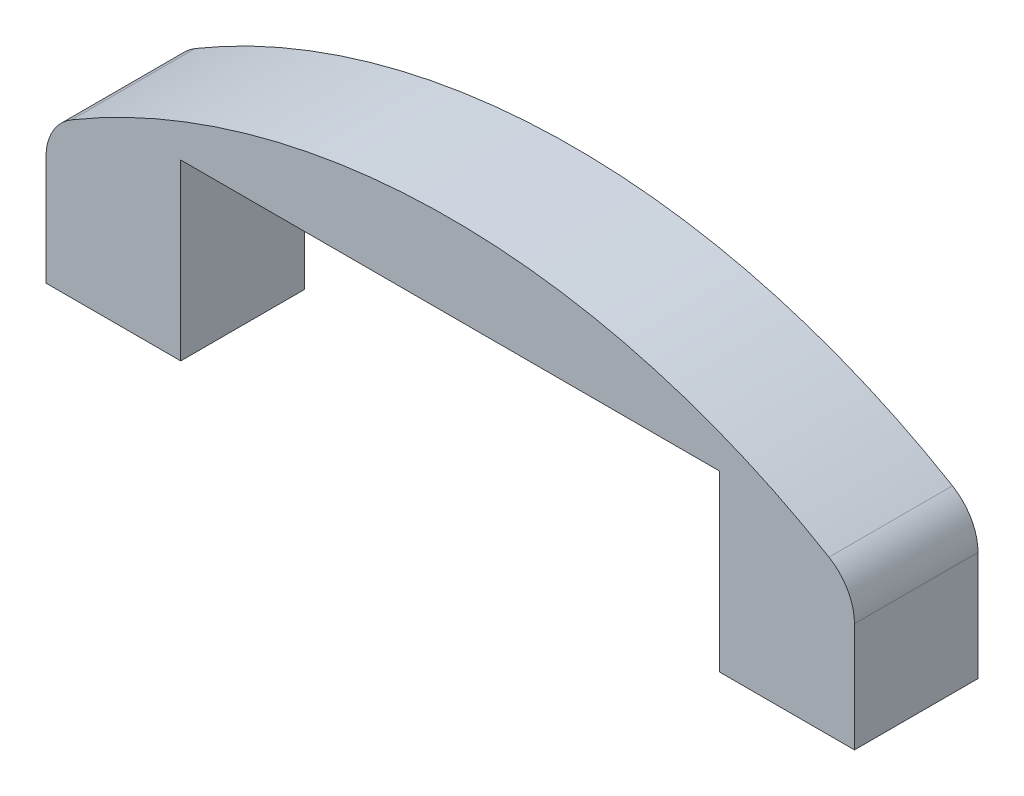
SolidWorks part; units mm, degrees
ref_plane "Plan de face" through (0, 0, 0) normal (0, 0, 1) x (1, 0, 0)
ref_plane "Plan de dessus" through (0, 0, 0) normal (0, 1, 0) x (1, 0, 0)
ref_plane "Plan de droite" through (0, 0, 0) normal (1, 0, 0) x (0, 0, -1)
ref_plane "Plan1" through (0, 0, 11) normal (0, 0, 1) x (1, 0, 0)
sketch "Esquisse1" plane through (0, 0, 11) normal (0, 0, 1) x (1, 0, 0)
  line L0 (-12, 24.6345) -> (-12, 0)
  line L1 (-12, 0) -> (132, 0)
  line L2 (132, 0) -> (132, 24.6345)
  arc A0 (132, 24.6345) -> (-12, 24.6345) centre (60, -86) ccw
  dimension "D1" = 132
  dimension "D2" = 72
  dimension "D3" = 24.6345
extrude "Boss.-Extru.1" add sketch "Esquisse1" against normal blind 22
sketch "Esquisse2" plane through (0, 0, -11) normal (0, 0, -1) x (-1, 0, 0)
  line L0 (-108, 0) -> (-12, 0)
  line L1 (-12, 0) -> (-12, 31)
  line L2 (-12, 31) -> (-108, 31)
  line L3 (-108, 31) -> (-108, 0)
  line L4 (12, 24.6345) -> (12, 0) construction
  line L5 (12, 0) -> (-132, 0) construction
  dimension "D1" = 24
  dimension "D2" = 120
  dimension "D3" = 31
extrude "Enlèv. mat.-Extru.1" cut sketch "Esquisse2" against normal through all
ref_plane "Plan2" through (0, 0, 0) normal (0, 0, -1) x (-1, 0, 0)
sketch "Esquisse3" plane through (0, 0, 0) normal (0, 0, -1) x (-1, 0, 0)
  line L0 (-2.4585, 0) -> (0, 0)
  line L1 (0, 0) -> (0, 18.2194)
  line L2 (0, 18.2194) -> (-2.4585, 16.8)
  line L3 (-2.4585, 16.8) -> (-2.4585, 12.5415)
  line L4 (-2.4585, 12.5415) -> (-3, 12)
  line L5 (-3, 12) -> (-2.4585, 12)
  line L6 (-2.4585, 12) -> (-2.4585, 0)
  line L7 (0, 0) -> (0, 18.2195) construction
  dimension "D1" = 2.4585
  dimension "D2" = 3
  dimension "D3" = 12
  dimension "D4" = 12.5415
  dimension "D5" = 16.8
  dimension "D6" = 18.2194
revolve "Enlèvement de matière-Révolution1" cut sketch "Esquisse3" angle 360 about L7
sketch "Esquisse4" plane through (0, 0, 0) normal (0, 0, -1) x (-1, 0, 0)
  line L0 (-122.4585, 0) -> (-120, 0)
  line L1 (-120, 0) -> (-120, 18.2194)
  line L2 (-120, 18.2194) -> (-122.4585, 16.8)
  line L3 (-122.4585, 16.8) -> (-122.4585, 12.5415)
  line L4 (-122.4585, 12.5415) -> (-123, 12)
  line L5 (-123, 12) -> (-122.4585, 12)
  line L6 (-122.4585, 12) -> (-122.4585, 0)
  line L7 (-120, 0) -> (-120, 18.2195) construction
  dimension "D1" = 2.4585
  dimension "D2" = 3
  dimension "D3" = 12
  dimension "D4" = 12.5415
  dimension "D5" = 16.8
  dimension "D6" = 18.2194
revolve "Enlèvement de matière-Révolution2" cut sketch "Esquisse4" angle 360 about L7
chamfer "Chanfrein1" distance 0.5415 angle 45 2 edges at (120, 0, 2.4585) (0, 0, 2.4585)
fillet "Congé1" radius 9.3 2 edges at (-12, 24.6345, 0) (132, 24.6345, 0)
fillet "Congé2" [suppressed] radius 15.5
